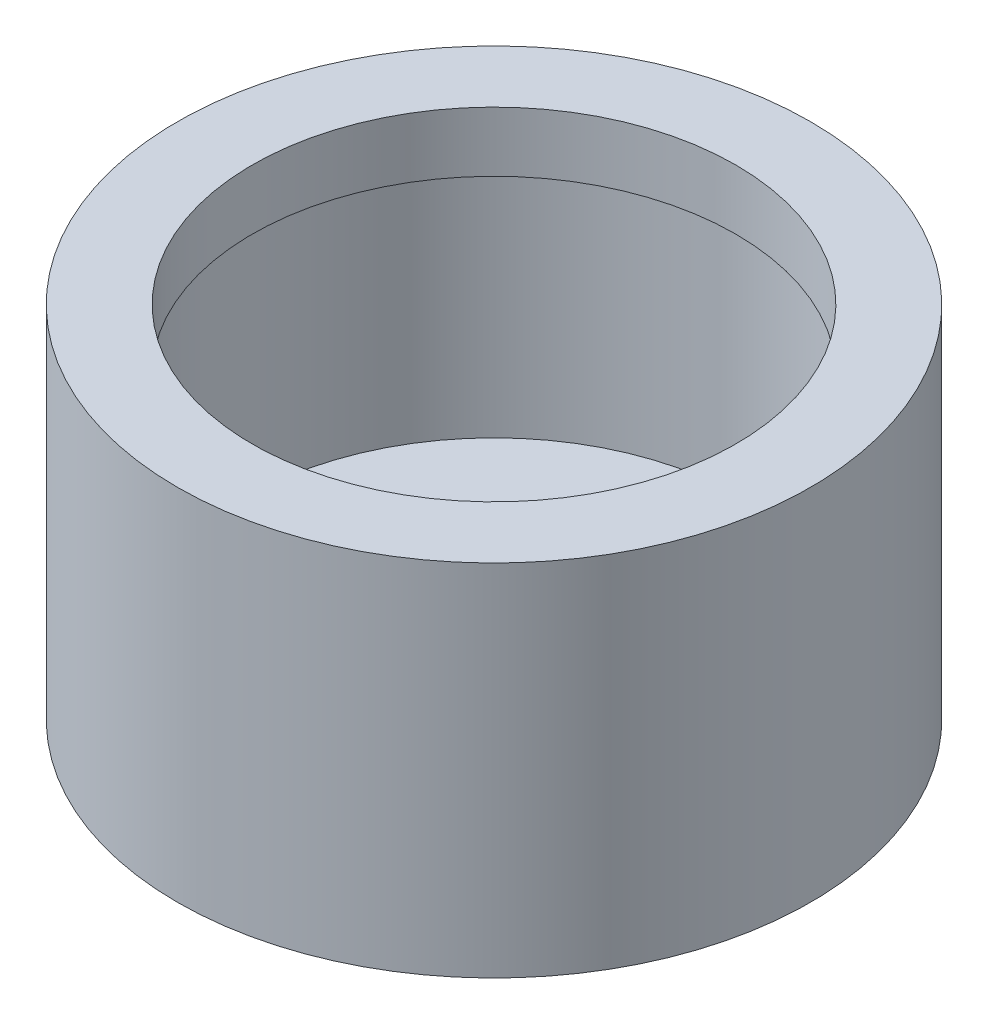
SolidWorks part; units mm, degrees
ref_plane "Front Plane" through (0, 0, 0) normal (0, 0, 1) x (1, 0, 0)
ref_plane "Top Plane" through (0, 0, 0) normal (0, 1, 0) x (1, 0, 0)
ref_plane "Right Plane" through (0, 0, 0) normal (1, 0, 0) x (0, 0, -1)
sketch "Sketch1" plane through (0, 0, 0) normal (0, 0, 1) x (1, 0, 0)
  line L0 (0, 0) -> (0, 4.064)
  line L1 (0, 4.064) -> (14.732, 4.064)
  line L2 (14.732, 4.064) -> (14.732, 17.78)
  line L3 (14.351, 21.336) -> (18.796, 21.336)
  line L4 (18.796, 21.336) -> (18.796, 0)
  line L5 (18.796, 0) -> (0, 0)
  line L6 (0, 4.064) -> (0, 21.336) construction
  line L7 (14.732, 17.78) -> (14.351, 17.78)
  line L8 (14.351, 17.78) -> (14.351, 21.336)
  dimension "D1" = 21.336
  dimension "D2" = 17.272
  dimension "D3" = 29.464
  dimension "D4" = 37.592
  dimension "D5" = 28.702
  dimension "D6" = 3.556
revolve "Body" add sketch "Sketch1" angle 360 about L6
sketch "Hole Locations" plane through (0, 0, 0) normal (0, -1, 0) x (1, 0, 0)
  line L0 (0, 0) -> (0, 14.732) construction
  line L1 (-7.62, 14.732) -> (7.62, 14.732) construction
  line L2 (0, 14.732) -> (0, 18.796) construction
  circle A0 centre (0, 0) radius 18.796 construction
  dimension "D1" = 4.064
  dimension "D2" = 7.62
hole_wizard "#4-40 Tapped Hole1" positions "Sketch3" profile "Sketch4" tap size "#4-40" standard "ANSI Inch"
sketch "Sketch3" plane through (0, 0, 0) normal (0, -1, 0) x (1, 0, 0)
  point P0 (-7.62, 14.732)
  point P3 (7.62, 14.732)
sketch "Sketch4" plane through (-7.62, 0, 14.732) normal (1, 0, 0) x (0, 0, -1)
  line L0 (0, 0) -> (0, 7.0292)
  line L1 (0, 7.0292) -> (1.1303, 6.35)
  line L2 (1.1303, 6.35) -> (1.1303, 0)
  line L5 (1.1303, 0) -> (0, 0)
  line L10 (0, 7.0292) -> (-1.1303, 6.35) construction
  line L11 (0, -6.35) -> (0, 107.95) construction
  dimension "Tap Drill Dia." = 2.2606
  dimension "Tap Drill Depth" = 6.35
  dimension "Drill Angle" = 118
